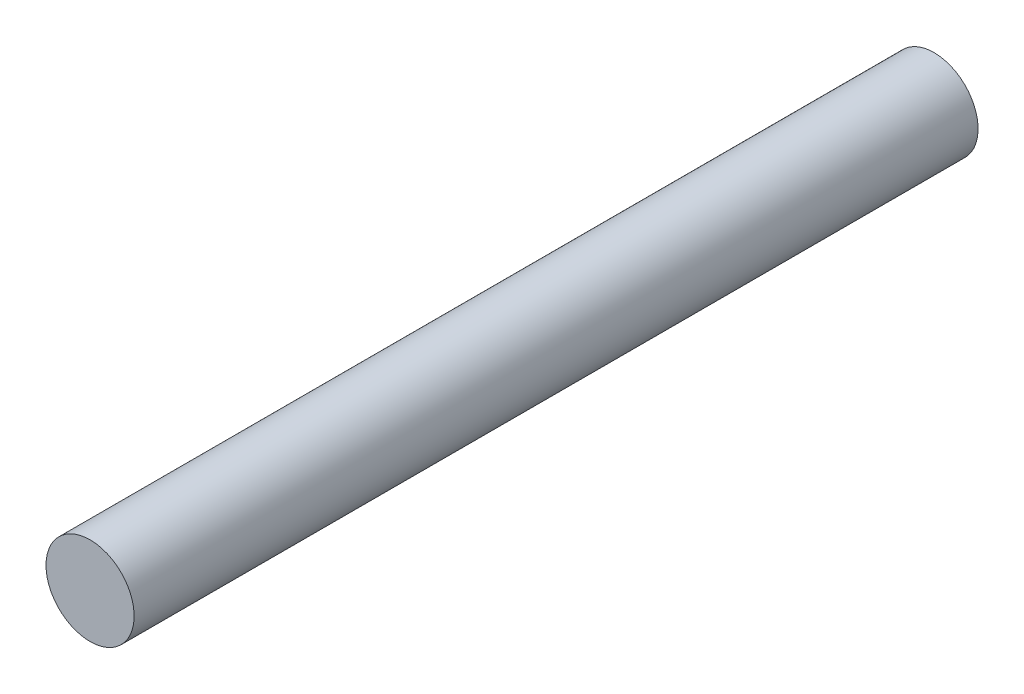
SolidWorks part; units mm, degrees
ref_plane "Front Plane" through (0, 0, 0) normal (0, 0, 1) x (1, 0, 0)
ref_plane "Top Plane" through (0, 0, 0) normal (0, 1, 0) x (1, 0, 0)
ref_plane "Right Plane" through (0, 0, 0) normal (1, 0, 0) x (0, 0, -1)
sketch "Sketch1" plane through (0, 0, 0) normal (0, 0, 1) x (1, 0, 0)
  circle A0 centre (0, 0) radius 3.175
  dimension "D1" = 6.35
extrude "Boss-Extrude1" add sketch "Sketch1" along normal mid plane 60.8
